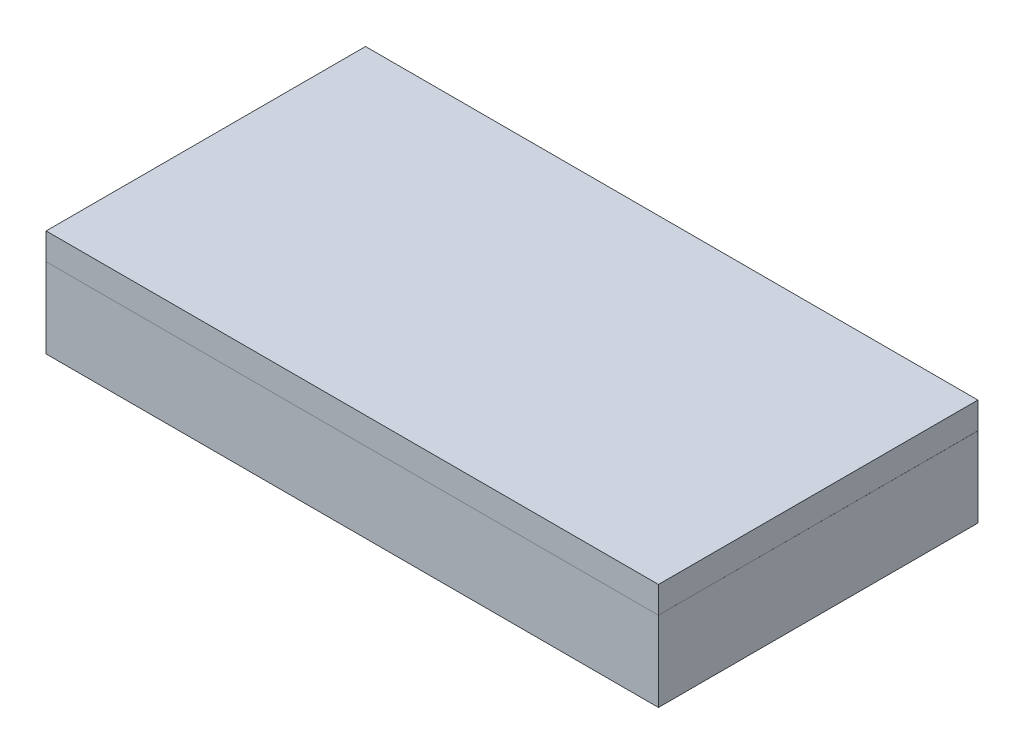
SolidWorks part; units mm, degrees
ref_plane "Front Plane" through (0, 0, 0) normal (0, 0, 1) x (1, 0, 0)
ref_plane "Top Plane" through (0, 0, 0) normal (0, 1, 0) x (1, 0, 0)
ref_plane "Right Plane" through (0, 0, 0) normal (1, 0, 0) x (0, 0, -1)
sketch "Sketch1" plane through (0, 0, 0) normal (0, 1, 0) x (1, 0, 0)
  line L1 (-57.5, -30) -> (57.5, -30)
  line L2 (-57.5, -30) -> (-57.5, 30)
  line L3 (-57.5, 30) -> (57.5, 30)
  line L4 (57.5, -30) -> (57.5, 30)
  line L5 (-57.5, -30) -> (57.5, 30) construction
  line L6 (-57.5, 30) -> (57.5, -30) construction
  point P0 (0, 0)
  dimension "D1" = 115
  dimension "D2" = 60
extrude "Boss-Extrude1" add sketch "Sketch1" along normal blind 15
sketch "Sketch2" plane through (0, 15, 0) normal (0, 1, 0) x (1, 0, 0)
  line L0 (-57.49, 29.99) -> (-57.49, -29.99)
  line L1 (-57.49, -29.99) -> (57.49, -29.99)
  line L2 (57.49, -29.99) -> (57.49, 29.99)
  line L3 (57.49, 29.99) -> (-57.49, 29.99)
  line L4 (57.5, -30) -> (57.5, 30)
  line L5 (57.5, 30) -> (-57.5, 30)
  line L6 (-57.5, 30) -> (-57.5, -30)
  line L7 (-57.5, -30) -> (57.5, -30)
  line L8 (57.5, -30) -> (57.5, 30)
  line L9 (57.5, 30) -> (-57.5, 30)
  line L10 (-57.5, 30) -> (-57.5, -30)
  line L11 (-57.5, -30) -> (57.5, -30) construction
  dimension "D1" = 0
  dimension "D2" = 0.01
extrude "Boss-Extrude4" add sketch "Sketch2" along normal blind 5 contours L2 L3 L0 L1
